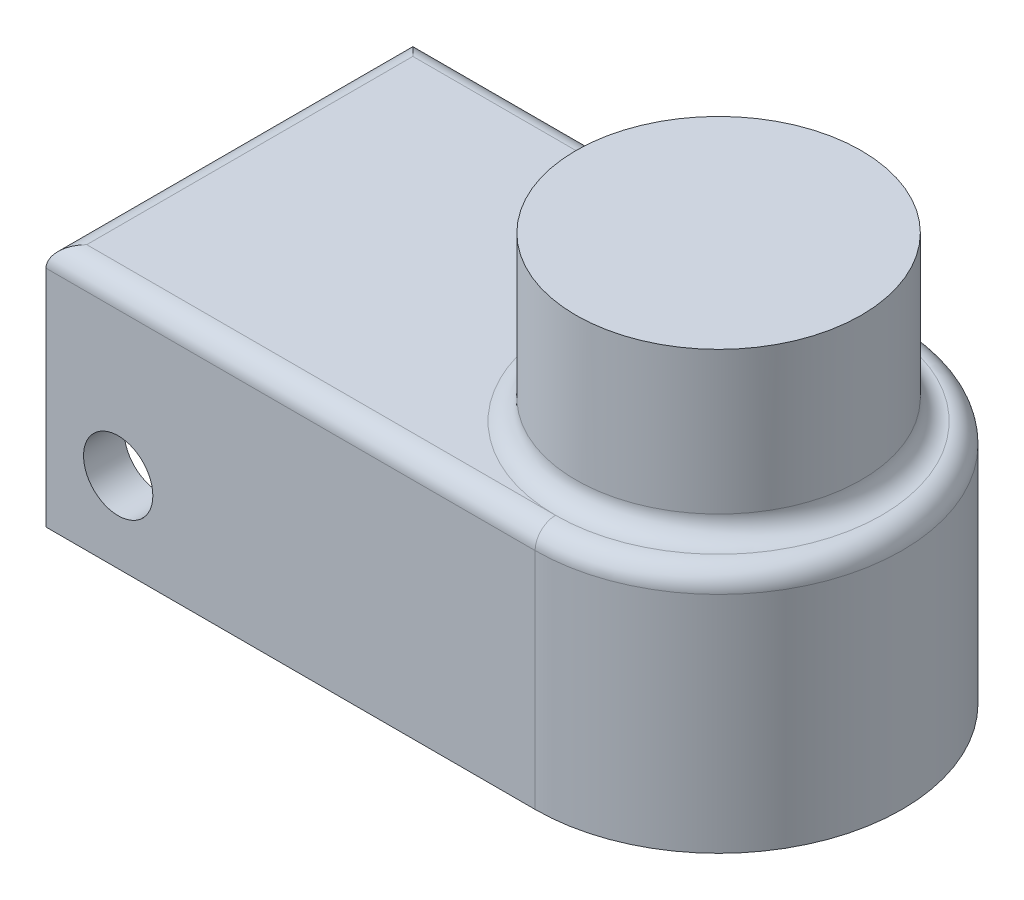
SolidWorks part; units mm, degrees
ref_plane "Front Plane" through (0, 0, 0) normal (0, 0, 1) x (1, 0, 0)
ref_plane "Top Plane" through (0, 0, 0) normal (0, 1, 0) x (1, 0, 0)
ref_plane "Right Plane" through (0, 0, 0) normal (1, 0, 0) x (0, 0, -1)
sketch "Sketch1"
  dimension "D1" = 114.3
  dimension "D2" = 152.4
extrude "Extrude1" add sketch "Sketch1" along normal blind 76.2
sketch "Sketch2"
  dimension "D1" = 12.7
extrude "Extrude2" cut sketch "Sketch2" against normal blind 37.592
sketch "Sketch4"
extrude "Extrude4" cut sketch "Sketch4" against normal through all
sketch "Sketch5"
  dimension "D1" = 88.9
extrude "Extrude5" add sketch "Sketch5" along normal blind 50.8
fillet "Fillet1" radius 6.35 5 edges at (76.2, 76.2, -114.3) (209.55, 76.2, -57.15) (0, 76.2, -57.15) (76.2, 76.2, 0) (152.4, 76.2, -101.6)
